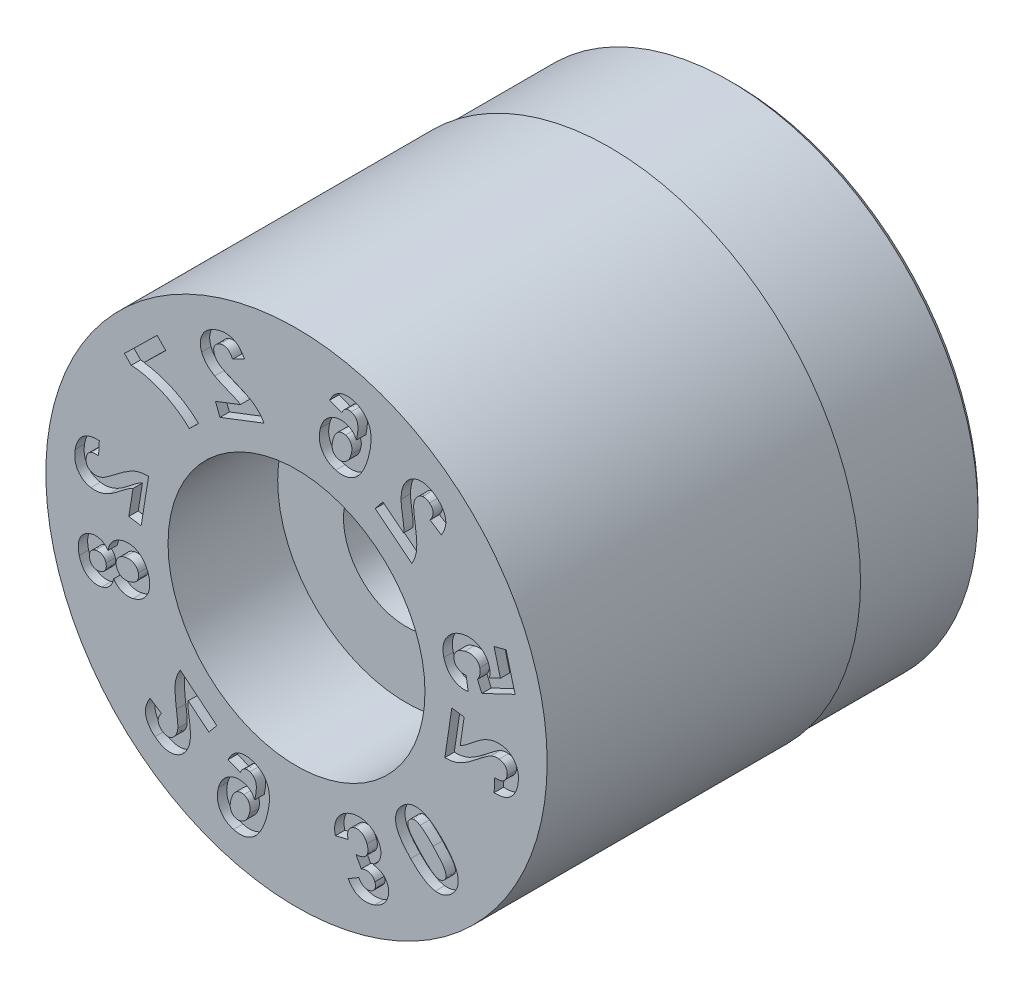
SolidWorks part; units mm, degrees
ref_plane "Front Plane" through (0, 0, 0) normal (0, 0, 1) x (1, 0, 0)
ref_plane "Top Plane" through (0, 0, 0) normal (0, 1, 0) x (1, 0, 0)
ref_plane "Right Plane" through (0, 0, 0) normal (1, 0, 0) x (0, 0, -1)
sketch "Sketch1" plane through (0, 0, 0) normal (1, 0, 0) x (0, 0, -1)
  line L2 (0, 8) -> (0, 4.1)
  line L3 (13.75, 8) -> (0, 8)
  line L4 (-3.7979, 0) -> (49996.2021, 0) construction
  line L8 (14, 2) -> (3.5, 2)
  line L9 (3.5, 4.1) -> (3.5, 2)
  line L10 (3.5, 4.1) -> (0, 4.1)
  line L12 (14, 2) -> (14, 7.75)
  line L16 (14, 7.75) -> (13.75, 8)
  dimension "D1" = 14
  dimension "D2" = 45
  dimension "D3" = 0.25
  dimension "D4" = 16
  dimension "D5" = 8.2
  dimension "D6" = 3.5
  dimension "D7" = 4
revolve "Revolve1" add sketch "Sketch1" angle 360 about L4
sketch "Sketch4" plane through (0, 0, 0) normal (1, 0, 0) x (0, 0, -1)
  line L0 (0, 0) -> (50000, 0) construction
  line L1 (14, -7.75) -> (14, 7.75) construction
  line L2 (10, 8.935) -> (14, 8.935)
  line L3 (10, 8.935) -> (10, 7.935)
  line L4 (10, 7.935) -> (14, 7.935)
  line L5 (14, 8.935) -> (14, 7.935)
  line L6 (13.75, 8) -> (0, 8) construction
  line L9 (0, 55) -> (0, -55) construction
  dimension "D1" = 1
  dimension "D2" = 0.065
  dimension "D3" = 10
revolve "Cut-Revolve1" cut sketch "Sketch4" angle 360 about L0
sketch "Sketch6" plane through (0, 0, 0) normal (0, 0, 1) x (1, 0, 0)
  arc A0 (4.7238, -1.5761) -> (4.4242, -2.2857) centre (0, 0) ccw construction
  text T0 "25 26 27 28 29 30" font "Arial" height 2.25
  dimension "D1" = 4.9798
extrude "Cut-Extrude1" cut sketch "Sketch6" against normal blind 0.3
